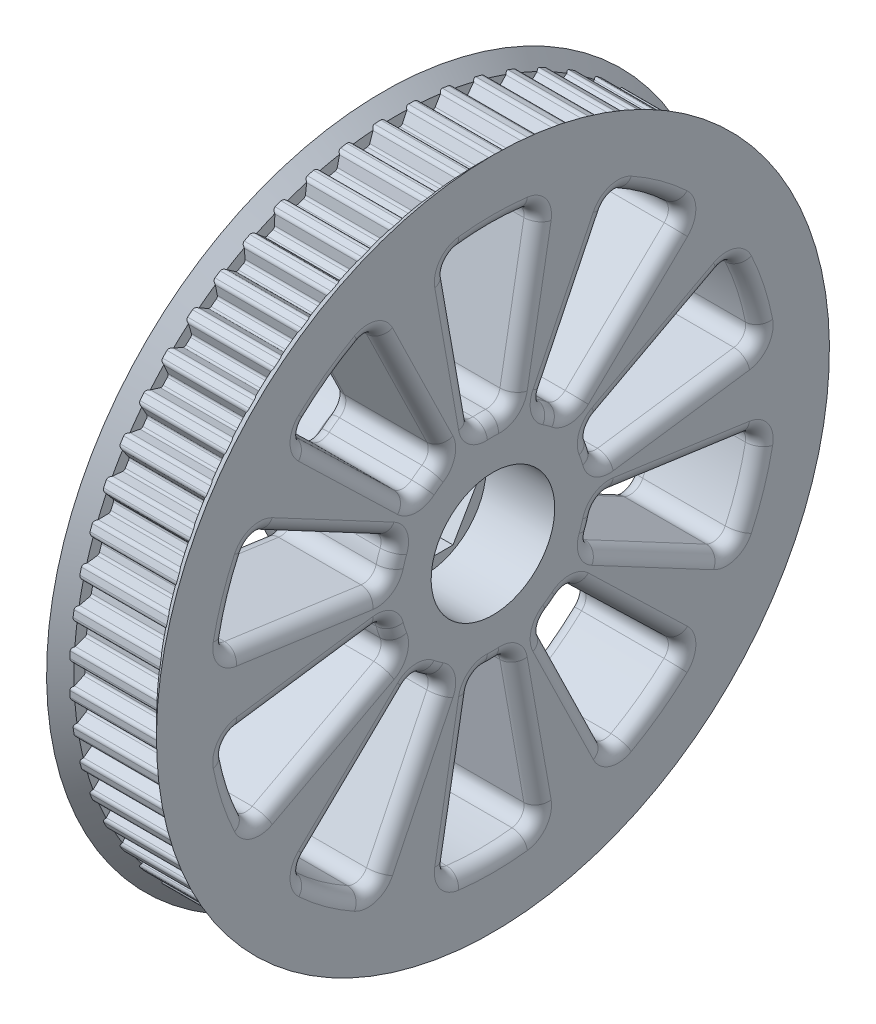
SolidWorks part; units mm, degrees
ref_plane "Plan de face" through (0, 0, 0) normal (0, 0, 1) x (1, 0, 0)
ref_plane "Plan de dessus" through (0, 0, 0) normal (0, 1, 0) x (1, 0, 0)
ref_plane "Plan de droite" through (0, 0, 0) normal (1, 0, 0) x (0, 0, -1)
ref_plane "Plan4" through (0, 0, 0) normal (0, 0, -1) x (-1, 0, 0)
sketch "Esquisse1" plane through (0, 0, 0) normal (0, 0, -1) x (-1, 0, 0)
  line L0 (-10.5, 47.325) -> (-10.5, 0)
  line L1 (-10.5, 0) -> (1.5, 0)
  line L2 (1.5, 0) -> (1.5, 47.325)
  line L3 (1.5, 47.325) -> (-10.5, 47.325)
  line L4 (-10.5, 0) -> (1.5, 0) construction
  dimension "D1" = 47.325
  dimension "D2" = 12
revolve "Révolution1" add sketch "Esquisse1" angle 360 about L4
sketch "Esquisse2" plane through (10.5, 0, 0) normal (1, 0, 0) x (0, 0, -1)
  line L0 (46.6005, -8.2494) -> (44.5277, -8.7279)
  line L1 (44.228, -10.1377) -> (45.927, -11.418)
  arc A0 (45.927, -11.418) -> (46.6005, -8.2494) centre (0, 0) ccw
  arc A1 (44.5277, -8.7279) -> (44.228, -10.1377) centre (0, 0) cw
extrude "Enlèv. mat.-Extru.1" cut sketch "Esquisse2" against normal through all
sketch "Esquisse3" plane through (10.5, 0, 0) normal (1, 0, 0) x (0, 0, -1)
  line L0 (45.4829, -13.0752) -> (43.3714, -13.3345)
  line L1 (42.9261, -14.7053) -> (44.4819, -16.1561)
  arc A0 (44.4819, -16.1561) -> (45.4829, -13.0752) centre (0, 0) ccw
  arc A1 (43.3714, -13.3345) -> (42.9261, -14.7053) centre (0, 0) cw
extrude "Enlèv. mat.-Extru.2" cut sketch "Esquisse3" against normal through all
sketch "Esquisse4" plane through (10.5, 0, 0) normal (1, 0, 0) x (0, 0, -1)
  line L0 (43.867, -17.7579) -> (41.74, -17.795)
  line L1 (41.1538, -19.1117) -> (42.5494, -20.7172)
  arc A0 (42.5494, -20.7172) -> (43.867, -17.7579) centre (0, 0) ccw
  arc A1 (41.74, -17.795) -> (41.1538, -19.1117) centre (0, 0) cw
extrude "Enlèv. mat.-Extru.3" cut sketch "Esquisse4" against normal through all
sketch "Esquisse5" plane through (10.5, 0, 0) normal (1, 0, 0) x (0, 0, -1)
  line L0 (41.7705, -22.2459) -> (39.6513, -22.0605)
  line L1 (38.9306, -23.3087) -> (40.1508, -25.0513)
  arc A0 (40.1508, -25.0513) -> (41.7705, -22.2459) centre (0, 0) ccw
  arc A1 (39.6513, -22.0605) -> (38.9306, -23.3087) centre (0, 0) cw
extrude "Enlèv. mat.-Extru.4" cut sketch "Esquisse5" against normal through all
sketch "Esquisse6" plane through (10.5, 0, 0) normal (1, 0, 0) x (0, 0, -1)
  line L0 (39.2163, -26.4903) -> (37.1281, -26.0844)
  line L1 (36.2809, -27.2504) -> (37.3123, -29.111)
  arc A0 (37.3123, -29.111) -> (39.2163, -26.4903) centre (0, 0) ccw
  arc A1 (37.1281, -26.0844) -> (36.2809, -27.2504) centre (0, 0) cw
extrude "Enlèv. mat.-Extru.5" cut sketch "Esquisse6" against normal through all
sketch "Esquisse7" plane through (10.5, 0, 0) normal (1, 0, 0) x (0, 0, -1)
  line L0 (36.2325, -30.4444) -> (34.1982, -29.8224)
  line L1 (33.2337, -30.8935) -> (34.0649, -32.8517)
  arc A0 (34.0649, -32.8517) -> (36.2325, -30.4444) centre (0, 0) ccw
  arc A1 (34.1982, -29.8224) -> (33.2337, -30.8935) centre (0, 0) cw
extrude "Enlèv. mat.-Extru.6" cut sketch "Esquisse7" against normal through all
sketch "Esquisse8" plane through (10.5, 0, 0) normal (1, 0, 0) x (0, 0, -1)
  line L0 (32.8517, -34.0649) -> (30.8935, -33.2337)
  line L1 (29.8224, -34.1982) -> (30.4444, -36.2325)
  arc A0 (30.4444, -36.2325) -> (32.8517, -34.0649) centre (0, 0) ccw
  arc A1 (30.8935, -33.2337) -> (29.8224, -34.1982) centre (0, 0) cw
extrude "Enlèv. mat.-Extru.7" cut sketch "Esquisse8" against normal through all
sketch "Esquisse9" plane through (10.5, 0, 0) normal (1, 0, 0) x (0, 0, -1)
  line L0 (29.111, -37.3123) -> (27.2504, -36.2809)
  line L1 (26.0844, -37.1281) -> (26.4903, -39.2163)
  arc A0 (26.4903, -39.2163) -> (29.111, -37.3123) centre (0, 0) ccw
  arc A1 (27.2504, -36.2809) -> (26.0844, -37.1281) centre (0, 0) cw
extrude "Enlèv. mat.-Extru.8" cut sketch "Esquisse9" against normal through all
sketch "Esquisse10" plane through (10.5, 0, 0) normal (1, 0, 0) x (0, 0, -1)
  line L0 (25.0513, -40.1508) -> (23.3087, -38.9306)
  line L1 (22.0605, -39.6513) -> (22.2459, -41.7705)
  arc A0 (22.2459, -41.7705) -> (25.0513, -40.1508) centre (0, 0) ccw
  arc A1 (23.3087, -38.9306) -> (22.0605, -39.6513) centre (0, 0) cw
extrude "Enlèv. mat.-Extru.9" cut sketch "Esquisse10" against normal through all
sketch "Esquisse11" plane through (10.5, 0, 0) normal (1, 0, 0) x (0, 0, -1)
  line L0 (20.7172, -42.5494) -> (19.1117, -41.1538)
  line L1 (17.795, -41.74) -> (17.7579, -43.867)
  arc A0 (17.7579, -43.867) -> (20.7172, -42.5494) centre (0, 0) ccw
  arc A1 (19.1117, -41.1538) -> (17.795, -41.74) centre (0, 0) cw
extrude "Enlèv. mat.-Extru.10" cut sketch "Esquisse11" against normal through all
sketch "Esquisse12" plane through (10.5, 0, 0) normal (1, 0, 0) x (0, 0, -1)
  line L0 (16.1561, -44.4819) -> (14.7053, -42.9261)
  line L1 (13.3345, -43.3714) -> (13.0752, -45.4829)
  arc A0 (13.0752, -45.4829) -> (16.1561, -44.4819) centre (0, 0) ccw
  arc A1 (14.7053, -42.9261) -> (13.3345, -43.3714) centre (0, 0) cw
extrude "Enlèv. mat.-Extru.11" cut sketch "Esquisse12" against normal through all
sketch "Esquisse13" plane through (10.5, 0, 0) normal (1, 0, 0) x (0, 0, -1)
  line L0 (11.418, -45.927) -> (10.1377, -44.228)
  line L1 (8.7279, -44.5277) -> (8.2494, -46.6005)
  arc A0 (8.2494, -46.6005) -> (11.418, -45.927) centre (0, 0) ccw
  arc A1 (10.1377, -44.228) -> (8.7279, -44.5277) centre (0, 0) cw
extrude "Enlèv. mat.-Extru.12" cut sketch "Esquisse13" against normal through all
sketch "Esquisse14" plane through (10.5, 0, 0) normal (1, 0, 0) x (0, 0, -1)
  line L0 (6.5547, -46.8689) -> (5.4591, -45.0454)
  line L1 (4.0257, -45.1961) -> (3.3331, -47.2075)
  arc A0 (3.3331, -47.2075) -> (6.5547, -46.8689) centre (0, 0) ccw
  arc A1 (5.4591, -45.0454) -> (4.0257, -45.1961) centre (0, 0) cw
extrude "Enlèv. mat.-Extru.13" cut sketch "Esquisse14" against normal through all
sketch "Esquisse15" plane through (10.5, 0, 0) normal (1, 0, 0) x (0, 0, -1)
  line L0 (1.6197, -47.2973) -> (0.7207, -45.3693)
  line L1 (-0.7207, -45.3693) -> (-1.6197, -47.2973)
  arc A0 (-1.6197, -47.2973) -> (1.6197, -47.2973) centre (0, 0) ccw
  arc A1 (0.7207, -45.3693) -> (-0.7207, -45.3693) centre (0, 0) cw
extrude "Enlèv. mat.-Extru.14" cut sketch "Esquisse15" against normal through all
sketch "Esquisse16" plane through (10.5, 0, 0) normal (1, 0, 0) x (0, 0, -1)
  line L0 (-3.3331, -47.2075) -> (-4.0257, -45.1961)
  line L1 (-5.4591, -45.0454) -> (-6.5547, -46.8689)
  arc A0 (-6.5547, -46.8689) -> (-3.3331, -47.2075) centre (0, 0) ccw
  arc A1 (-4.0257, -45.1961) -> (-5.4591, -45.0454) centre (0, 0) cw
extrude "Enlèv. mat.-Extru.15" cut sketch "Esquisse16" against normal through all
sketch "Esquisse17" plane through (10.5, 0, 0) normal (1, 0, 0) x (0, 0, -1)
  line L0 (-8.2494, -46.6005) -> (-8.7279, -44.5277)
  line L1 (-10.1377, -44.228) -> (-11.418, -45.927)
  arc A0 (-11.418, -45.927) -> (-8.2494, -46.6005) centre (0, 0) ccw
  arc A1 (-8.7279, -44.5277) -> (-10.1377, -44.228) centre (0, 0) cw
extrude "Enlèv. mat.-Extru.16" cut sketch "Esquisse17" against normal through all
sketch "Esquisse18" plane through (10.5, 0, 0) normal (1, 0, 0) x (0, 0, -1)
  line L0 (-13.0752, -45.4829) -> (-13.3345, -43.3714)
  line L1 (-14.7053, -42.9261) -> (-16.1561, -44.4819)
  arc A0 (-16.1561, -44.4819) -> (-13.0752, -45.4829) centre (0, 0) ccw
  arc A1 (-13.3345, -43.3714) -> (-14.7053, -42.9261) centre (0, 0) cw
extrude "Enlèv. mat.-Extru.17" cut sketch "Esquisse18" against normal through all
sketch "Esquisse19" plane through (10.5, 0, 0) normal (1, 0, 0) x (0, 0, -1)
  line L0 (-17.7579, -43.867) -> (-17.795, -41.74)
  line L1 (-19.1117, -41.1538) -> (-20.7172, -42.5494)
  arc A0 (-20.7172, -42.5494) -> (-17.7579, -43.867) centre (0, 0) ccw
  arc A1 (-17.795, -41.74) -> (-19.1117, -41.1538) centre (0, 0) cw
extrude "Enlèv. mat.-Extru.18" cut sketch "Esquisse19" against normal through all
sketch "Esquisse20" plane through (10.5, 0, 0) normal (1, 0, 0) x (0, 0, -1)
  line L0 (-22.2459, -41.7705) -> (-22.0605, -39.6513)
  line L1 (-23.3087, -38.9306) -> (-25.0513, -40.1508)
  arc A0 (-25.0513, -40.1508) -> (-22.2459, -41.7705) centre (0, 0) ccw
  arc A1 (-22.0605, -39.6513) -> (-23.3087, -38.9306) centre (0, 0) cw
extrude "Enlèv. mat.-Extru.19" cut sketch "Esquisse20" against normal through all
sketch "Esquisse21" plane through (10.5, 0, 0) normal (1, 0, 0) x (0, 0, -1)
  line L0 (-26.4903, -39.2163) -> (-26.0844, -37.1281)
  line L1 (-27.2504, -36.2809) -> (-29.111, -37.3123)
  arc A0 (-29.111, -37.3123) -> (-26.4903, -39.2163) centre (0, 0) ccw
  arc A1 (-26.0844, -37.1281) -> (-27.2504, -36.2809) centre (0, 0) cw
extrude "Enlèv. mat.-Extru.20" cut sketch "Esquisse21" against normal through all
sketch "Esquisse22" plane through (10.5, 0, 0) normal (1, 0, 0) x (0, 0, -1)
  line L0 (-30.4444, -36.2325) -> (-29.8224, -34.1982)
  line L1 (-30.8935, -33.2337) -> (-32.8517, -34.0649)
  arc A0 (-32.8517, -34.0649) -> (-30.4444, -36.2325) centre (0, 0) ccw
  arc A1 (-29.8224, -34.1982) -> (-30.8935, -33.2337) centre (0, 0) cw
extrude "Enlèv. mat.-Extru.21" cut sketch "Esquisse22" against normal through all
sketch "Esquisse23" plane through (10.5, 0, 0) normal (1, 0, 0) x (0, 0, -1)
  line L0 (-34.0649, -32.8517) -> (-33.2337, -30.8935)
  line L1 (-34.1982, -29.8224) -> (-36.2325, -30.4444)
  arc A0 (-36.2325, -30.4444) -> (-34.0649, -32.8517) centre (0, 0) ccw
  arc A1 (-33.2337, -30.8935) -> (-34.1982, -29.8224) centre (0, 0) cw
extrude "Enlèv. mat.-Extru.22" cut sketch "Esquisse23" against normal through all
sketch "Esquisse24" plane through (10.5, 0, 0) normal (1, 0, 0) x (0, 0, -1)
  line L0 (-37.3123, -29.111) -> (-36.2809, -27.2504)
  line L1 (-37.1281, -26.0844) -> (-39.2163, -26.4903)
  arc A0 (-39.2163, -26.4903) -> (-37.3123, -29.111) centre (0, 0) ccw
  arc A1 (-36.2809, -27.2504) -> (-37.1281, -26.0844) centre (0, 0) cw
extrude "Enlèv. mat.-Extru.23" cut sketch "Esquisse24" against normal through all
sketch "Esquisse25" plane through (10.5, 0, 0) normal (1, 0, 0) x (0, 0, -1)
  line L0 (-40.1508, -25.0513) -> (-38.9306, -23.3087)
  line L1 (-39.6513, -22.0605) -> (-41.7705, -22.2459)
  arc A0 (-41.7705, -22.2459) -> (-40.1508, -25.0513) centre (0, 0) ccw
  arc A1 (-38.9306, -23.3087) -> (-39.6513, -22.0605) centre (0, 0) cw
extrude "Enlèv. mat.-Extru.24" cut sketch "Esquisse25" against normal through all
sketch "Esquisse26" plane through (10.5, 0, 0) normal (1, 0, 0) x (0, 0, -1)
  line L0 (-42.5494, -20.7172) -> (-41.1538, -19.1117)
  line L1 (-41.74, -17.795) -> (-43.867, -17.7579)
  arc A0 (-43.867, -17.7579) -> (-42.5494, -20.7172) centre (0, 0) ccw
  arc A1 (-41.1538, -19.1117) -> (-41.74, -17.795) centre (0, 0) cw
extrude "Enlèv. mat.-Extru.25" cut sketch "Esquisse26" against normal through all
sketch "Esquisse27" plane through (10.5, 0, 0) normal (1, 0, 0) x (0, 0, -1)
  line L0 (-44.4819, -16.1561) -> (-42.9261, -14.7053)
  line L1 (-43.3714, -13.3345) -> (-45.4829, -13.0752)
  arc A0 (-45.4829, -13.0752) -> (-44.4819, -16.1561) centre (0, 0) ccw
  arc A1 (-42.9261, -14.7053) -> (-43.3714, -13.3345) centre (0, 0) cw
extrude "Enlèv. mat.-Extru.26" cut sketch "Esquisse27" against normal through all
sketch "Esquisse28" plane through (10.5, 0, 0) normal (1, 0, 0) x (0, 0, -1)
  line L0 (-45.927, -11.418) -> (-44.228, -10.1377)
  line L1 (-44.5277, -8.7279) -> (-46.6005, -8.2494)
  arc A0 (-46.6005, -8.2494) -> (-45.927, -11.418) centre (0, 0) ccw
  arc A1 (-44.228, -10.1377) -> (-44.5277, -8.7279) centre (0, 0) cw
extrude "Enlèv. mat.-Extru.27" cut sketch "Esquisse28" against normal through all
sketch "Esquisse29" plane through (10.5, 0, 0) normal (1, 0, 0) x (0, 0, -1)
  line L0 (-46.8689, -6.5547) -> (-45.0454, -5.4591)
  line L1 (-45.1961, -4.0257) -> (-47.2075, -3.3331)
  arc A0 (-47.2075, -3.3331) -> (-46.8689, -6.5547) centre (0, 0) ccw
  arc A1 (-45.0454, -5.4591) -> (-45.1961, -4.0257) centre (0, 0) cw
extrude "Enlèv. mat.-Extru.28" cut sketch "Esquisse29" against normal through all
sketch "Esquisse30" plane through (10.5, 0, 0) normal (1, 0, 0) x (0, 0, -1)
  line L0 (-47.2973, -1.6197) -> (-45.3693, -0.7207)
  line L1 (-45.3693, 0.7207) -> (-47.2973, 1.6197)
  arc A0 (-47.2973, 1.6197) -> (-47.2973, -1.6197) centre (0, 0) ccw
  arc A1 (-45.3693, -0.7207) -> (-45.3693, 0.7207) centre (0, 0) cw
extrude "Enlèv. mat.-Extru.29" cut sketch "Esquisse30" against normal through all
sketch "Esquisse31" plane through (10.5, 0, 0) normal (1, 0, 0) x (0, 0, -1)
  line L0 (-47.2075, 3.3331) -> (-45.1961, 4.0257)
  line L1 (-45.0454, 5.4591) -> (-46.8689, 6.5547)
  arc A0 (-46.8689, 6.5547) -> (-47.2075, 3.3331) centre (0, 0) ccw
  arc A1 (-45.1961, 4.0257) -> (-45.0454, 5.4591) centre (0, 0) cw
extrude "Enlèv. mat.-Extru.30" cut sketch "Esquisse31" against normal through all
sketch "Esquisse32" plane through (10.5, 0, 0) normal (1, 0, 0) x (0, 0, -1)
  line L0 (-46.6005, 8.2494) -> (-44.5277, 8.7279)
  line L1 (-44.228, 10.1377) -> (-45.927, 11.418)
  arc A0 (-45.927, 11.418) -> (-46.6005, 8.2494) centre (0, 0) ccw
  arc A1 (-44.5277, 8.7279) -> (-44.228, 10.1377) centre (0, 0) cw
extrude "Enlèv. mat.-Extru.31" cut sketch "Esquisse32" against normal through all
sketch "Esquisse33" plane through (10.5, 0, 0) normal (1, 0, 0) x (0, 0, -1)
  line L0 (-45.4829, 13.0752) -> (-43.3714, 13.3345)
  line L1 (-42.9261, 14.7053) -> (-44.4819, 16.1561)
  arc A0 (-44.4819, 16.1561) -> (-45.4829, 13.0752) centre (0, 0) ccw
  arc A1 (-43.3714, 13.3345) -> (-42.9261, 14.7053) centre (0, 0) cw
extrude "Enlèv. mat.-Extru.32" cut sketch "Esquisse33" against normal through all
sketch "Esquisse34" plane through (10.5, 0, 0) normal (1, 0, 0) x (0, 0, -1)
  line L0 (-43.867, 17.7579) -> (-41.74, 17.795)
  line L1 (-41.1538, 19.1117) -> (-42.5494, 20.7172)
  arc A0 (-42.5494, 20.7172) -> (-43.867, 17.7579) centre (0, 0) ccw
  arc A1 (-41.74, 17.795) -> (-41.1538, 19.1117) centre (0, 0) cw
extrude "Enlèv. mat.-Extru.33" cut sketch "Esquisse34" against normal through all
sketch "Esquisse35" plane through (10.5, 0, 0) normal (1, 0, 0) x (0, 0, -1)
  line L0 (-41.7705, 22.2459) -> (-39.6513, 22.0605)
  line L1 (-38.9306, 23.3087) -> (-40.1508, 25.0513)
  arc A0 (-40.1508, 25.0513) -> (-41.7705, 22.2459) centre (0, 0) ccw
  arc A1 (-39.6513, 22.0605) -> (-38.9306, 23.3087) centre (0, 0) cw
extrude "Enlèv. mat.-Extru.34" cut sketch "Esquisse35" against normal through all
sketch "Esquisse36" plane through (10.5, 0, 0) normal (1, 0, 0) x (0, 0, -1)
  line L0 (-39.2163, 26.4903) -> (-37.1281, 26.0844)
  line L1 (-36.2809, 27.2504) -> (-37.3123, 29.111)
  arc A0 (-37.3123, 29.111) -> (-39.2163, 26.4903) centre (0, 0) ccw
  arc A1 (-37.1281, 26.0844) -> (-36.2809, 27.2504) centre (0, 0) cw
extrude "Enlèv. mat.-Extru.35" cut sketch "Esquisse36" against normal through all
sketch "Esquisse37" plane through (10.5, 0, 0) normal (1, 0, 0) x (0, 0, -1)
  line L0 (-36.2325, 30.4444) -> (-34.1982, 29.8224)
  line L1 (-33.2337, 30.8935) -> (-34.0649, 32.8517)
  arc A0 (-34.0649, 32.8517) -> (-36.2325, 30.4444) centre (0, 0) ccw
  arc A1 (-34.1982, 29.8224) -> (-33.2337, 30.8935) centre (0, 0) cw
extrude "Enlèv. mat.-Extru.36" cut sketch "Esquisse37" against normal through all
sketch "Esquisse38" plane through (10.5, 0, 0) normal (1, 0, 0) x (0, 0, -1)
  line L0 (-32.8517, 34.0649) -> (-30.8935, 33.2337)
  line L1 (-29.8224, 34.1982) -> (-30.4444, 36.2325)
  arc A0 (-30.4444, 36.2325) -> (-32.8517, 34.0649) centre (0, 0) ccw
  arc A1 (-30.8935, 33.2337) -> (-29.8224, 34.1982) centre (0, 0) cw
extrude "Enlèv. mat.-Extru.37" cut sketch "Esquisse38" against normal through all
sketch "Esquisse39" plane through (10.5, 0, 0) normal (1, 0, 0) x (0, 0, -1)
  line L0 (-29.111, 37.3123) -> (-27.2504, 36.2809)
  line L1 (-26.0844, 37.1281) -> (-26.4903, 39.2163)
  arc A0 (-26.4903, 39.2163) -> (-29.111, 37.3123) centre (0, 0) ccw
  arc A1 (-27.2504, 36.2809) -> (-26.0844, 37.1281) centre (0, 0) cw
extrude "Enlèv. mat.-Extru.38" cut sketch "Esquisse39" against normal through all
sketch "Esquisse40" plane through (10.5, 0, 0) normal (1, 0, 0) x (0, 0, -1)
  line L0 (-25.0513, 40.1508) -> (-23.3087, 38.9306)
  line L1 (-22.0605, 39.6513) -> (-22.2459, 41.7705)
  arc A0 (-22.2459, 41.7705) -> (-25.0513, 40.1508) centre (0, 0) ccw
  arc A1 (-23.3087, 38.9306) -> (-22.0605, 39.6513) centre (0, 0) cw
extrude "Enlèv. mat.-Extru.39" cut sketch "Esquisse40" against normal through all
sketch "Esquisse41" plane through (10.5, 0, 0) normal (1, 0, 0) x (0, 0, -1)
  line L0 (-20.7172, 42.5494) -> (-19.1117, 41.1538)
  line L1 (-17.795, 41.74) -> (-17.7579, 43.867)
  arc A0 (-17.7579, 43.867) -> (-20.7172, 42.5494) centre (0, 0) ccw
  arc A1 (-19.1117, 41.1538) -> (-17.795, 41.74) centre (0, 0) cw
extrude "Enlèv. mat.-Extru.40" cut sketch "Esquisse41" against normal through all
sketch "Esquisse42" plane through (10.5, 0, 0) normal (1, 0, 0) x (0, 0, -1)
  line L0 (-16.1561, 44.4819) -> (-14.7053, 42.9261)
  line L1 (-13.3345, 43.3714) -> (-13.0752, 45.4829)
  arc A0 (-13.0752, 45.4829) -> (-16.1561, 44.4819) centre (0, 0) ccw
  arc A1 (-14.7053, 42.9261) -> (-13.3345, 43.3714) centre (0, 0) cw
extrude "Enlèv. mat.-Extru.41" cut sketch "Esquisse42" against normal through all
sketch "Esquisse43" plane through (10.5, 0, 0) normal (1, 0, 0) x (0, 0, -1)
  line L0 (-11.418, 45.927) -> (-10.1377, 44.228)
  line L1 (-8.7279, 44.5277) -> (-8.2494, 46.6005)
  arc A0 (-8.2494, 46.6005) -> (-11.418, 45.927) centre (0, 0) ccw
  arc A1 (-10.1377, 44.228) -> (-8.7279, 44.5277) centre (0, 0) cw
extrude "Enlèv. mat.-Extru.42" cut sketch "Esquisse43" against normal through all
sketch "Esquisse44" plane through (10.5, 0, 0) normal (1, 0, 0) x (0, 0, -1)
  line L0 (-6.5547, 46.8689) -> (-5.4591, 45.0454)
  line L1 (-4.0257, 45.1961) -> (-3.3331, 47.2075)
  arc A0 (-3.3331, 47.2075) -> (-6.5547, 46.8689) centre (0, 0) ccw
  arc A1 (-5.4591, 45.0454) -> (-4.0257, 45.1961) centre (0, 0) cw
extrude "Enlèv. mat.-Extru.43" cut sketch "Esquisse44" against normal through all
sketch "Esquisse45" plane through (10.5, 0, 0) normal (1, 0, 0) x (0, 0, -1)
  line L0 (-1.6197, 47.2973) -> (-0.7207, 45.3693)
  line L1 (0.7207, 45.3693) -> (1.6197, 47.2973)
  arc A0 (1.6197, 47.2973) -> (-1.6197, 47.2973) centre (0, 0) ccw
  arc A1 (-0.7207, 45.3693) -> (0.7207, 45.3693) centre (0, 0) cw
extrude "Enlèv. mat.-Extru.44" cut sketch "Esquisse45" against normal through all
sketch "Esquisse46" plane through (10.5, 0, 0) normal (1, 0, 0) x (0, 0, -1)
  line L0 (3.3331, 47.2075) -> (4.0257, 45.1961)
  line L1 (5.4591, 45.0454) -> (6.5547, 46.8689)
  arc A0 (6.5547, 46.8689) -> (3.3331, 47.2075) centre (0, 0) ccw
  arc A1 (4.0257, 45.1961) -> (5.4591, 45.0454) centre (0, 0) cw
extrude "Enlèv. mat.-Extru.45" cut sketch "Esquisse46" against normal through all
sketch "Esquisse47" plane through (10.5, 0, 0) normal (1, 0, 0) x (0, 0, -1)
  line L0 (8.2494, 46.6005) -> (8.7279, 44.5277)
  line L1 (10.1377, 44.228) -> (11.418, 45.927)
  arc A0 (11.418, 45.927) -> (8.2494, 46.6005) centre (0, 0) ccw
  arc A1 (8.7279, 44.5277) -> (10.1377, 44.228) centre (0, 0) cw
extrude "Enlèv. mat.-Extru.46" cut sketch "Esquisse47" against normal through all
sketch "Esquisse48" plane through (10.5, 0, 0) normal (1, 0, 0) x (0, 0, -1)
  line L0 (13.0752, 45.4829) -> (13.3345, 43.3714)
  line L1 (14.7053, 42.9261) -> (16.1561, 44.4819)
  arc A0 (16.1561, 44.4819) -> (13.0752, 45.4829) centre (0, 0) ccw
  arc A1 (13.3345, 43.3714) -> (14.7053, 42.9261) centre (0, 0) cw
extrude "Enlèv. mat.-Extru.47" cut sketch "Esquisse48" against normal through all
sketch "Esquisse49" plane through (10.5, 0, 0) normal (1, 0, 0) x (0, 0, -1)
  line L0 (17.7579, 43.867) -> (17.795, 41.74)
  line L1 (19.1117, 41.1538) -> (20.7172, 42.5494)
  arc A0 (20.7172, 42.5494) -> (17.7579, 43.867) centre (0, 0) ccw
  arc A1 (17.795, 41.74) -> (19.1117, 41.1538) centre (0, 0) cw
extrude "Enlèv. mat.-Extru.48" cut sketch "Esquisse49" against normal through all
sketch "Esquisse50" plane through (10.5, 0, 0) normal (1, 0, 0) x (0, 0, -1)
  line L0 (22.2459, 41.7705) -> (22.0605, 39.6513)
  line L1 (23.3087, 38.9306) -> (25.0513, 40.1508)
  arc A0 (25.0513, 40.1508) -> (22.2459, 41.7705) centre (0, 0) ccw
  arc A1 (22.0605, 39.6513) -> (23.3087, 38.9306) centre (0, 0) cw
extrude "Enlèv. mat.-Extru.49" cut sketch "Esquisse50" against normal through all
sketch "Esquisse51" plane through (10.5, 0, 0) normal (1, 0, 0) x (0, 0, -1)
  line L0 (26.4903, 39.2163) -> (26.0844, 37.1281)
  line L1 (27.2504, 36.2809) -> (29.111, 37.3123)
  arc A0 (29.111, 37.3123) -> (26.4903, 39.2163) centre (0, 0) ccw
  arc A1 (26.0844, 37.1281) -> (27.2504, 36.2809) centre (0, 0) cw
extrude "Enlèv. mat.-Extru.50" cut sketch "Esquisse51" against normal through all
sketch "Esquisse52" plane through (10.5, 0, 0) normal (1, 0, 0) x (0, 0, -1)
  line L0 (30.4444, 36.2325) -> (29.8224, 34.1982)
  line L1 (30.8935, 33.2337) -> (32.8517, 34.0649)
  arc A0 (32.8517, 34.0649) -> (30.4444, 36.2325) centre (0, 0) ccw
  arc A1 (29.8224, 34.1982) -> (30.8935, 33.2337) centre (0, 0) cw
extrude "Enlèv. mat.-Extru.51" cut sketch "Esquisse52" against normal through all
sketch "Esquisse53" plane through (10.5, 0, 0) normal (1, 0, 0) x (0, 0, -1)
  line L0 (34.0649, 32.8517) -> (33.2337, 30.8935)
  line L1 (34.1982, 29.8224) -> (36.2325, 30.4444)
  arc A0 (36.2325, 30.4444) -> (34.0649, 32.8517) centre (0, 0) ccw
  arc A1 (33.2337, 30.8935) -> (34.1982, 29.8224) centre (0, 0) cw
extrude "Enlèv. mat.-Extru.52" cut sketch "Esquisse53" against normal through all
sketch "Esquisse54" plane through (10.5, 0, 0) normal (1, 0, 0) x (0, 0, -1)
  line L0 (37.3123, 29.111) -> (36.2809, 27.2504)
  line L1 (37.1281, 26.0844) -> (39.2163, 26.4903)
  arc A0 (39.2163, 26.4903) -> (37.3123, 29.111) centre (0, 0) ccw
  arc A1 (36.2809, 27.2504) -> (37.1281, 26.0844) centre (0, 0) cw
extrude "Enlèv. mat.-Extru.53" cut sketch "Esquisse54" against normal through all
sketch "Esquisse55" plane through (10.5, 0, 0) normal (1, 0, 0) x (0, 0, -1)
  line L0 (40.1508, 25.0513) -> (38.9306, 23.3087)
  line L1 (39.6513, 22.0605) -> (41.7705, 22.2459)
  arc A0 (41.7705, 22.2459) -> (40.1508, 25.0513) centre (0, 0) ccw
  arc A1 (38.9306, 23.3087) -> (39.6513, 22.0605) centre (0, 0) cw
extrude "Enlèv. mat.-Extru.54" cut sketch "Esquisse55" against normal through all
sketch "Esquisse56" plane through (10.5, 0, 0) normal (1, 0, 0) x (0, 0, -1)
  line L0 (42.5494, 20.7172) -> (41.1538, 19.1117)
  line L1 (41.74, 17.795) -> (43.867, 17.7579)
  arc A0 (43.867, 17.7579) -> (42.5494, 20.7172) centre (0, 0) ccw
  arc A1 (41.1538, 19.1117) -> (41.74, 17.795) centre (0, 0) cw
extrude "Enlèv. mat.-Extru.55" cut sketch "Esquisse56" against normal through all
sketch "Esquisse57" plane through (10.5, 0, 0) normal (1, 0, 0) x (0, 0, -1)
  line L0 (44.4819, 16.1561) -> (42.9261, 14.7053)
  line L1 (43.3714, 13.3345) -> (45.4829, 13.0752)
  arc A0 (45.4829, 13.0752) -> (44.4819, 16.1561) centre (0, 0) ccw
  arc A1 (42.9261, 14.7053) -> (43.3714, 13.3345) centre (0, 0) cw
extrude "Enlèv. mat.-Extru.56" cut sketch "Esquisse57" against normal through all
sketch "Esquisse58" plane through (10.5, 0, 0) normal (1, 0, 0) x (0, 0, -1)
  line L0 (45.927, 11.418) -> (44.228, 10.1377)
  line L1 (44.5277, 8.7279) -> (46.6005, 8.2494)
  arc A0 (46.6005, 8.2494) -> (45.927, 11.418) centre (0, 0) ccw
  arc A1 (44.228, 10.1377) -> (44.5277, 8.7279) centre (0, 0) cw
extrude "Enlèv. mat.-Extru.57" cut sketch "Esquisse58" against normal through all
sketch "Esquisse59" plane through (10.5, 0, 0) normal (1, 0, 0) x (0, 0, -1)
  line L0 (46.8689, 6.5547) -> (45.0454, 5.4591)
  line L1 (45.1961, 4.0257) -> (47.2075, 3.3331)
  arc A0 (47.2075, 3.3331) -> (46.8689, 6.5547) centre (0, 0) ccw
  arc A1 (45.0454, 5.4591) -> (45.1961, 4.0257) centre (0, 0) cw
extrude "Enlèv. mat.-Extru.58" cut sketch "Esquisse59" against normal through all
sketch "Esquisse60" plane through (10.5, 0, 0) normal (1, 0, 0) x (0, 0, -1)
  line L0 (47.2973, 1.6197) -> (45.3693, 0.7207)
  line L1 (45.3693, -0.7207) -> (47.2973, -1.6197)
  arc A0 (47.2973, -1.6197) -> (47.2973, 1.6197) centre (0, 0) ccw
  arc A1 (45.3693, 0.7207) -> (45.3693, -0.7207) centre (0, 0) cw
extrude "Enlèv. mat.-Extru.59" cut sketch "Esquisse60" against normal through all
sketch "Esquisse61" plane through (10.5, 0, 0) normal (1, 0, 0) x (0, 0, -1)
  line L0 (47.2075, -3.3331) -> (45.1961, -4.0257)
  line L1 (45.0454, -5.4591) -> (46.8689, -6.5547)
  arc A0 (46.8689, -6.5547) -> (47.2075, -3.3331) centre (0, 0) ccw
  arc A1 (45.1961, -4.0257) -> (45.0454, -5.4591) centre (0, 0) cw
extrude "Enlèv. mat.-Extru.60" cut sketch "Esquisse61" against normal through all
fillet "Congé1" radius 0.4 120 edges at (4.5, -44.228, -10.1377) (4.5, -45.3693, -0.7207) (4.5, -45.0454, -5.4591) (4.5, 8.7279, 44.5277) (4.5, -45.1961, 4.0257) (4.5, 10.1377, 44.228) (4.5, -13.3345, -43.3714) (4.5, -44.5277, 8.7279) (4.5, -33.2337, -30.8935) (4.5, -44.228, 10.1377) (4.5, -22.0605, -39.6513) (4.5, 13.3345, 43.3714) (4.5, -36.2809, -27.2504) (4.5, 14.7053, 42.9261) (4.5, -23.3087, 38.9306) (4.5, -8.7279, -44.5277) (4.5, -19.1117, 41.1538) (4.5, -10.1377, -44.228) (4.5, -14.7053, 42.9261) (4.5, 17.795, 41.74) (4.5, -10.1377, 44.228) (4.5, 19.1117, 41.1538) (4.5, -5.4591, 45.0454) (4.5, -43.3714, 13.3345) (4.5, -0.7207, 45.3693) (4.5, -42.9261, 14.7053) (4.5, 4.0257, 45.1961) (4.5, 22.0605, 39.6513) (4.5, 44.5277, -8.7279) (4.5, 23.3087, 38.9306) (4.5, 43.3714, -13.3345) (4.5, -38.9306, -23.3087) (4.5, 41.74, -17.795) (4.5, -39.6513, -22.0605) (4.5, 39.6513, -22.0605) (4.5, 26.0844, 37.1281) (4.5, 37.1281, -26.0844) (4.5, 27.2504, 36.2809) (4.5, 34.1982, -29.8224) (4.5, -41.74, 17.795) (4.5, 30.8935, -33.2337) (4.5, -41.1538, 19.1117) (4.5, 27.2504, -36.2809) (4.5, 29.8224, 34.1982) (4.5, 23.3087, -38.9306) (4.5, 30.8935, 33.2337) (4.5, 19.1117, -41.1538) (4.5, -26.0844, -37.1281) (4.5, 14.7053, -42.9261) (4.5, -27.2504, -36.2809) (4.5, 10.1377, -44.228) (4.5, 33.2337, 30.8935) (4.5, 5.4591, -45.0454) (4.5, 34.1982, 29.8224) (4.5, 0.7207, -45.3693) (4.5, -39.6513, 22.0605) (4.5, -4.0257, -45.1961) (4.5, -38.9306, 23.3087) (4.5, -26.0844, 37.1281) (4.5, 36.2809, 27.2504) (4.5, 44.228, -10.1377) (4.5, 37.1281, 26.0844) (4.5, -44.5277, -8.7279) (4.5, -41.1538, -19.1117) (4.5, 42.9261, -14.7053) (4.5, -41.74, -17.795) (4.5, -22.0605, 39.6513) (4.5, 38.9306, 23.3087) (4.5, 41.1538, -19.1117) (4.5, 39.6513, 22.0605) (4.5, -14.7053, -42.9261) (4.5, -37.1281, 26.0844) (4.5, 38.9306, -23.3087) (4.5, -36.2809, 27.2504) (4.5, -17.795, 41.74) (4.5, 41.1538, 19.1117) (4.5, 36.2809, -27.2504) (4.5, 41.74, 17.795) (4.5, -45.1961, -4.0257) (4.5, -17.795, -41.74) (4.5, 33.2337, -30.8935) (4.5, -19.1117, -41.1538) (4.5, -13.3345, 43.3714) (4.5, 42.9261, 14.7053) (4.5, 29.8224, -34.1982) (4.5, 43.3714, 13.3345) (4.5, -34.1982, -29.8224) (4.5, -34.1982, 29.8224) (4.5, 26.0844, -37.1281) (4.5, -33.2337, 30.8935) (4.5, -8.7279, 44.5277) (4.5, 44.228, 10.1377) (4.5, 22.0605, -39.6513) (4.5, 44.5277, 8.7279) (4.5, -45.3693, 0.7207) (4.5, -42.9261, -14.7053) (4.5, 17.795, -41.74) (4.5, -43.3714, -13.3345) (4.5, -4.0257, 45.1961) (4.5, 45.0454, 5.4591) (4.5, 13.3345, -43.3714) (4.5, 45.1961, 4.0257) (4.5, -23.3087, -38.9306) (4.5, -30.8935, 33.2337) (4.5, 8.7279, -44.5277) (4.5, -29.8224, 34.1982) (4.5, 0.7207, 45.3693) (4.5, 45.3693, 0.7207) (4.5, 4.0257, -45.1961) (4.5, 45.3693, -0.7207) (4.5, -45.0454, 5.4591) (4.5, -29.8224, -34.1982) (4.5, -0.7207, -45.3693) (4.5, -30.8935, -33.2337) (4.5, 5.4591, 45.0454) (4.5, 45.1961, -4.0257) (4.5, -5.4591, -45.0454) (4.5, 45.0454, -5.4591) (4.5, -37.1281, -26.0844) (4.5, -27.2504, 36.2809)
fillet "Congé2" radius 0.6 120 edges at (4.5, 16.1561, 44.4819) (4.5, 42.5494, -20.7172) (4.5, 43.867, 17.7579) (4.5, -11.418, -45.927) (4.5, 13.0752, -45.4829) (4.5, -13.0752, -45.4829) (4.5, 32.8517, 34.0649) (4.5, -16.1561, -44.4819) (4.5, 47.2973, -1.6197) (4.5, -17.7579, -43.867) (4.5, 30.4444, -36.2325) (4.5, -20.7172, -42.5494) (4.5, -6.5547, -46.8689) (4.5, -22.2459, -41.7705) (4.5, 25.0513, 40.1508) (4.5, -25.0513, -40.1508) (4.5, 39.2163, 26.4903) (4.5, -26.4903, -39.2163) (4.5, 46.6005, 8.2494) (4.5, -29.111, -37.3123) (4.5, 45.927, -11.418) (4.5, -30.4444, -36.2325) (4.5, 37.3123, -29.111) (4.5, -32.8517, -34.0649) (4.5, 22.2459, -41.7705) (4.5, -34.0649, -32.8517) (4.5, 3.3331, -47.2075) (4.5, -36.2325, -30.4444) (4.5, 11.418, 45.927) (4.5, -37.3123, -29.111) (4.5, 20.7172, 42.5494) (4.5, -39.2163, -26.4903) (4.5, 29.111, 37.3123) (4.5, -40.1508, -25.0513) (4.5, 36.2325, 30.4444) (4.5, -41.7705, -22.2459) (4.5, 41.7705, 22.2459) (4.5, -42.5494, -20.7172) (4.5, 45.4829, 13.0752) (4.5, -43.867, -17.7579) (4.5, 47.2075, 3.3331) (4.5, -44.4819, -16.1561) (4.5, 46.8689, -6.5547) (4.5, -45.4829, -13.0752) (4.5, 44.4819, -16.1561) (4.5, -45.927, -11.418) (4.5, 40.1508, -25.0513) (4.5, -46.6005, -8.2494) (4.5, 34.0649, -32.8517) (4.5, -46.8689, -6.5547) (4.5, 26.4903, -39.2163) (4.5, -47.2075, -3.3331) (4.5, 17.7579, -43.867) (4.5, -47.2973, -1.6197) (4.5, 8.2494, -46.6005) (4.5, -47.2973, 1.6197) (4.5, -1.6197, -47.2973) (4.5, -47.2075, 3.3331) (4.5, 8.2494, 46.6005) (4.5, -46.8689, 6.5547) (4.5, 13.0752, 45.4829) (4.5, -46.6005, 8.2494) (4.5, 17.7579, 43.867) (4.5, -45.927, 11.418) (4.5, 22.2459, 41.7705) (4.5, -45.4829, 13.0752) (4.5, 26.4903, 39.2163) (4.5, -44.4819, 16.1561) (4.5, 30.4444, 36.2325) (4.5, -43.867, 17.7579) (4.5, 34.0649, 32.8517) (4.5, -42.5494, 20.7172) (4.5, 37.3123, 29.111) (4.5, -41.7705, 22.2459) (4.5, 40.1508, 25.0513) (4.5, -40.1508, 25.0513) (4.5, 42.5494, 20.7172) (4.5, -39.2163, 26.4903) (4.5, 44.4819, 16.1561) (4.5, -37.3123, 29.111) (4.5, 45.927, 11.418) (4.5, -36.2325, 30.4444) (4.5, 46.8689, 6.5547) (4.5, -34.0649, 32.8517) (4.5, 47.2973, 1.6197) (4.5, -32.8517, 34.0649) (4.5, 47.2075, -3.3331) (4.5, -30.4444, 36.2325) (4.5, 46.6005, -8.2494) (4.5, -29.111, 37.3123) (4.5, 45.4829, -13.0752) (4.5, -26.4903, 39.2163) (4.5, 43.867, -17.7579) (4.5, -25.0513, 40.1508) (4.5, 41.7705, -22.2459) (4.5, -22.2459, 41.7705) (4.5, 39.2163, -26.4903) (4.5, -20.7172, 42.5494) (4.5, 36.2325, -30.4444) (4.5, -17.7579, 43.867) (4.5, 32.8517, -34.0649) (4.5, -16.1561, 44.4819) (4.5, 29.111, -37.3123) (4.5, -13.0752, 45.4829) (4.5, 25.0513, -40.1508) (4.5, -11.418, 45.927) (4.5, 20.7172, -42.5494) (4.5, -8.2494, 46.6005) (4.5, 16.1561, -44.4819) (4.5, -6.5547, 46.8689) (4.5, 11.418, -45.927) (4.5, -3.3331, 47.2075) (4.5, 6.5547, -46.8689) (4.5, -1.6197, 47.2973) (4.5, 1.6197, -47.2973) (4.5, 1.6197, 47.2973) (4.5, -3.3331, -47.2075) (4.5, 3.3331, 47.2075) (4.5, -8.2494, -46.6005) (4.5, 6.5547, 46.8689)
sketch "Esquisse62" plane through (10.5, 0, 0) normal (1, 0, 0) x (0, 0, -1)
  circle A0 centre (0, 0) radius 49
  dimension "D1" = 98
extrude "Boss.-Extru.1" add sketch "Esquisse62" along normal blind 2
sketch "Esquisse63" plane through (-1.5, 0, 0) normal (-1, 0, 0) x (0, 0, 1)
  circle A1 centre (0, 0) radius 49
  dimension "D1" = 98
extrude "Boss.-Extru.2" add sketch "Esquisse63" along normal blind 2
sketch "Esquisse66" plane through (-3.5, 0, 0) normal (-1, 0, 0) x (0, 0, 1)
  circle A0 centre (0, 0) radius 11.5
  dimension "D1" = 23
extrude "Boss.-Extru.3" add sketch "Esquisse66" along normal blind 6.5
fillet "Congé5" radius 2 1 edges at (-3.5, -11.5, 0)
sketch "Esquisse64" plane through (-3.5, 0, 0) normal (-1, 0, 0) x (0, 0, 1)
  line L1 (8.3716, 0) -> (4.1858, 7.25)
  line L2 (4.1858, 7.25) -> (-4.1858, 7.25)
  line L3 (-4.1858, 7.25) -> (-8.3716, 0)
  line L4 (-8.3716, 0) -> (-4.1858, -7.25)
  line L5 (-4.1858, -7.25) -> (4.1858, -7.25)
  line L6 (4.1858, -7.25) -> (8.3716, 0)
  circle A0 centre (0, 0) radius 7.25 construction
  dimension "D1" = 14.5
extrude "Enlèv. mat.-Extru.61" cut sketch "Esquisse64" against normal through all and the other way through all
sketch "Esquisse65" plane through (12.5, 0, 0) normal (1, 0, 0) x (0, 0, -1)
  line L0 (0, 0) -> (0, 51.9609) construction
  line L1 (-2.6915, 15.2645) -> (-6.8591, 38.8999)
  line L2 (2.6915, 15.2645) -> (6.8591, 38.8999)
  arc A0 (2.6915, 15.2645) -> (-2.6915, 15.2645) centre (0, 0) ccw
  arc A1 (6.8591, 38.8999) -> (-6.8591, 38.8999) centre (0, 0) ccw
  dimension "D1" = 79
  dimension "D2" = 31
  dimension "D3" = 10
  dimension "D4" = 10
extrude "Enlèv. mat.-Extru.62" cut sketch "Esquisse65" against normal through all
pattern_circular "Répétition circulaire1" count 10 over 360 about axis through (0, 0, 0) along (1, 0, 0) of "Enlèv. mat.-Extru.62"
fillet "Congé4" radius 2 120 edges at (-3.5, 12.9105, 24.2811) (12.5, 12.9105, 24.2811) (-3.5, 3.8273, 27.2324) (12.5, 3.8273, 27.2324) (4.5, 18.5441, 34.8764) (-3.5, 12.2062, 37.5667) (4.5, 5.4973, 39.1156) (12.5, 12.2062, 37.5667) (4.5, 2.1572, 15.3492) (-3.5, 4.7898, 14.7414) (4.5, 7.2768, 13.6857) (12.5, 4.7898, 14.7414) (-3.5, 24.7168, 12.0552) (12.5, 24.7168, 12.0552) (-3.5, 19.1031, 19.7818) (12.5, 19.1031, 19.7818) (4.5, 10.7672, 11.1498) (-3.5, 12.5398, 9.1107) (4.5, 13.9313, 6.7948) (12.5, 12.5398, 9.1107) (4.5, 35.5024, 17.3157) (-3.5, 31.9562, 23.2175) (4.5, 27.439, 28.4139) (12.5, 31.9562, 23.2175) (-3.5, -12.9105, 24.2811) (12.5, -12.9105, 24.2811) (-3.5, -3.8273, 27.2324) (12.5, -3.8273, 27.2324) (-3.5, 3.8273, -27.2324) (12.5, 3.8273, -27.2324) (-3.5, 12.9105, -24.2811) (12.5, 12.9105, -24.2811) (-3.5, -12.9105, -24.2811) (12.5, -12.9105, -24.2811) (-3.5, -3.8273, -27.2324) (12.5, -3.8273, -27.2324) (-3.5, -24.7168, -12.0552) (12.5, -24.7168, -12.0552) (-3.5, -19.1031, -19.7818) (12.5, -19.1031, -19.7818) (-3.5, -27.0822, 4.7753) (12.5, -27.0822, 4.7753) (-3.5, -27.0822, -4.7753) (12.5, -27.0822, -4.7753) (-3.5, -19.1031, 19.7818) (12.5, -19.1031, 19.7818) (-3.5, -24.7168, 12.0552) (12.5, -24.7168, 12.0552) (-3.5, 24.7168, -12.0552) (12.5, 24.7168, -12.0552) (-3.5, 19.1031, -19.7818) (12.5, 19.1031, -19.7818) (-3.5, 27.0822, -4.7753) (12.5, 27.0822, -4.7753) (-3.5, 27.0822, 4.7753) (12.5, 27.0822, 4.7753) (4.5, -5.4973, 39.1156) (-3.5, -12.2062, 37.5667) (4.5, -18.5441, 34.8764) (12.5, -12.2062, 37.5667) (4.5, 27.439, -28.4139) (-3.5, 31.9562, -23.2175) (4.5, 35.5024, -17.3157) (12.5, 31.9562, -23.2175) (4.5, -7.2768, 13.6857) (-3.5, -4.7898, 14.7414) (4.5, -2.1572, 15.3492) (12.5, -4.7898, 14.7414) (4.5, -13.9313, 6.7948) (-3.5, -12.5398, 9.1107) (4.5, -10.7672, 11.1498) (12.5, -12.5398, 9.1107) (4.5, -15.2645, -2.6915) (-3.5, -15.5, 0) (4.5, -15.2645, 2.6915) (12.5, -15.5, 0) (4.5, -10.7672, -11.1498) (-3.5, -12.5398, -9.1107) (4.5, -13.9313, -6.7948) (12.5, -12.5398, -9.1107) (4.5, -2.1572, -15.3492) (-3.5, -4.7898, -14.7414) (4.5, -7.2768, -13.6857) (12.5, -4.7898, -14.7414) (4.5, 7.2768, -13.6857) (-3.5, 4.7898, -14.7414) (4.5, 2.1572, -15.3492) (12.5, 4.7898, -14.7414) (4.5, 5.4973, -39.1156) (-3.5, 12.2062, -37.5667) (4.5, 18.5441, -34.8764) (12.5, 12.2062, -37.5667) (4.5, -18.5441, -34.8764) (-3.5, -12.2062, -37.5667) (4.5, -5.4973, -39.1156) (12.5, -12.2062, -37.5667) (4.5, -35.5024, -17.3157) (-3.5, -31.9562, -23.2175) (4.5, -27.439, -28.4139) (12.5, -31.9562, -23.2175) (4.5, -38.8999, 6.8591) (-3.5, -39.5, 0) (4.5, -38.8999, -6.8591) (12.5, -39.5, 0) (4.5, -27.439, 28.4139) (-3.5, -31.9562, 23.2175) (4.5, -35.5024, 17.3157) (12.5, -31.9562, 23.2175) (4.5, 13.9313, -6.7948) (-3.5, 12.5398, -9.1107) (4.5, 10.7672, -11.1498) (12.5, 12.5398, -9.1107) (4.5, 15.2645, 2.6915) (-3.5, 15.5, 0) (4.5, 15.2645, -2.6915) (12.5, 15.5, 0) (4.5, 38.8999, -6.8591) (-3.5, 39.5, 0) (4.5, 38.8999, 6.8591) (12.5, 39.5, 0)
chamfer "Chanfrein1" distance 1 angle 45 6 edges at (-10, -7.25, 0) (-10, -3.625, -6.2787) (-10, 3.625, -6.2787) (-10, 7.25, 0) (-10, 3.625, 6.2787) (-10, -3.625, 6.2787)
chamfer "Chanfrein2" distance 2 angle 45 2 edges at (10.5, 49, 0) (-1.5, -49, 0)
sketch "Esquisse69" plane through (12.5, 0, 0) normal (1, 0, 0) x (0, 0, -1)
  circle A0 centre (0, 0) radius 9
  dimension "D1" = 18
extrude "Enlèv. mat.-Extru.63" cut sketch "Esquisse69" against normal blind 10
